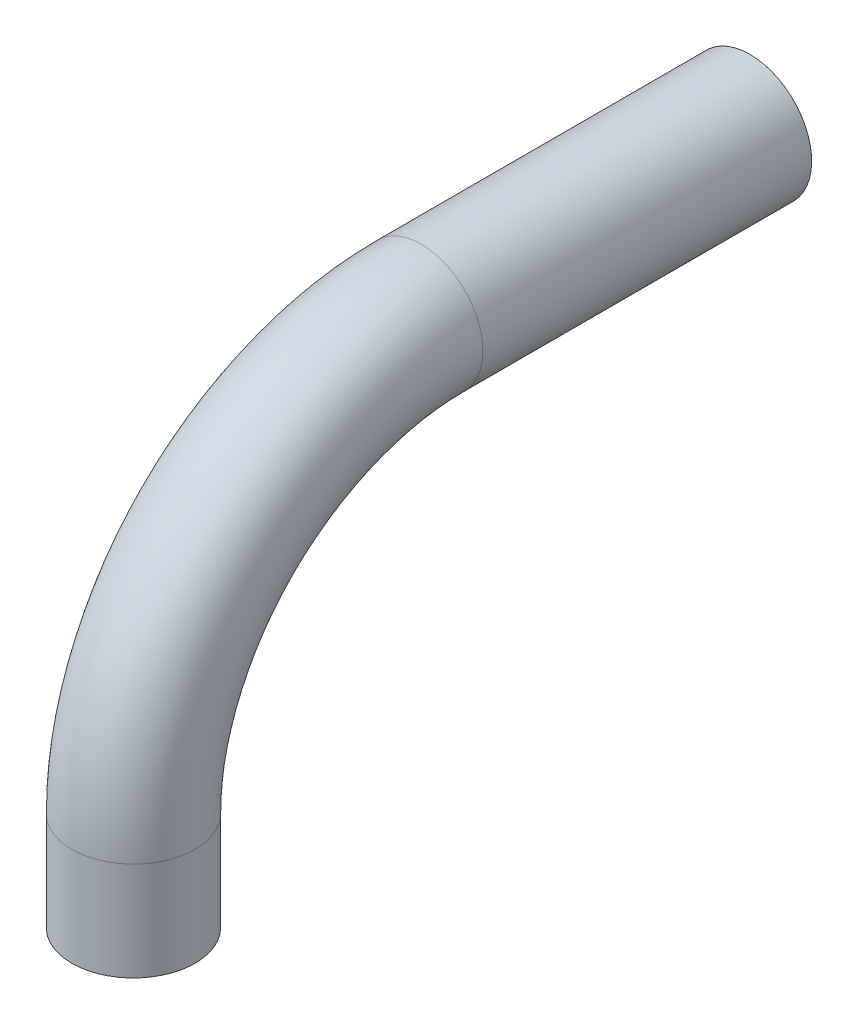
SolidWorks part; units mm, degrees
ref_plane "Front Plane" through (0, 0, 0) normal (0, 0, 1) x (1, 0, 0)
ref_plane "Top Plane" through (0, 0, 0) normal (0, 1, 0) x (1, 0, 0)
ref_plane "Right Plane" through (0, 0, 0) normal (1, 0, 0) x (0, 0, -1)
sketch "Sketch1" plane through (0, 0, 0) normal (0, 1, 0) x (1, 0, 0)
  circle A0 centre (0, 0) radius 2.3812
  circle A1 centre (0, 0) radius 1.778
sketch "Sketch2" plane through (0, 0, 0) normal (1, 0, 0) x (0, 0, -1)
  line L0 (0, 0) -> (0, 3.81)
  line L2 (11.1125, 14.9225) -> (23.8125, 14.9225)
  arc A0 (11.1125, 14.9225) -> (0, 3.81) centre (11.1125, 3.81) ccw
  dimension "D1" = 11.1125
  dimension "D2" = 3.81
sweep "Sweep1" add profiles "Sketch1" path "Sketch2"
